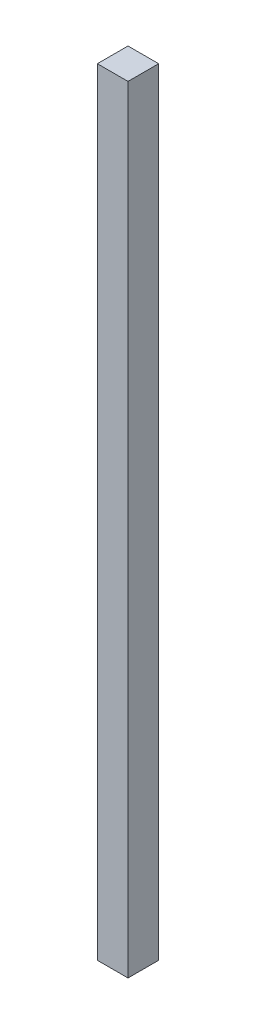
SolidWorks part; units mm, degrees
ref_plane "前视基准面" through (0, 0, 0) normal (0, 0, 1) x (1, 0, 0)
ref_plane "上视基准面" through (0, 0, 0) normal (0, 1, 0) x (1, 0, 0)
ref_plane "右视基准面" through (0, 0, 0) normal (1, 0, 0) x (0, 0, -1)
other "Configuration Table"
sketch "草图1" plane through (0, 0, 0) normal (0, 1, 0) x (1, 0, 0)
  line L1 (-30, 30) -> (30, 30)
  line L2 (-30, 30) -> (-30, -30)
  line L3 (-30, -30) -> (30, -30)
  line L4 (30, 30) -> (30, -30)
  line L5 (-30, 30) -> (30, -30) construction
  line L6 (-30, -30) -> (30, 30) construction
  point P0 (0, 0)
extrude "凸台-拉伸1" add sketch "草图1" along normal blind 1520
sketch "草图2" plane through (0, 0, 30) normal (0, 0, 1) x (1, 0, 0)
  line L0 (-30, 60) -> (30, 60)
  line L1 (-30, 1520) -> (-30, 0) construction
  line L2 (30, 1520) -> (30, 0) construction
  line L3 (-30, 0) -> (30, 0) construction
  line L4 (-30, 1460) -> (30, 1460)
  line L5 (-30, 1520) -> (30, 1520) construction
  dimension "D1" = 60
  dimension "D2" = 60
sketch "草图4" plane through (0, 0, 30) normal (0, 0, 1) x (1, 0, 0)
  line L0 (0, 1460) -> (0, 60)
  line L1 (-30, 1460) -> (30, 1460) construction
  line L2 (-30, 60) -> (30, 60) construction
